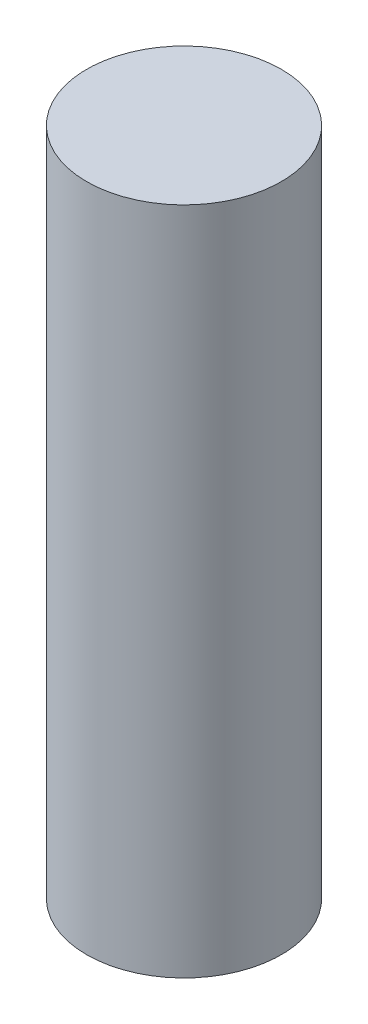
SolidWorks part; units mm, degrees
ref_plane "Front Plane" through (0, 0, 0) normal (0, 0, 1) x (1, 0, 0)
ref_plane "Top Plane" through (0, 0, 0) normal (0, 1, 0) x (1, 0, 0)
ref_plane "Right Plane" through (0, 0, 0) normal (1, 0, 0) x (0, 0, -1)
sketch "Sketch1" plane through (0, 0, 0) normal (0, 1, 0) x (1, 0, 0)
  circle A0 centre (0, 0) radius 2.4003
  dimension "D1" = 4.8006
extrude "Boss-Extrude1" add sketch "Sketch1" along normal blind 16.51
